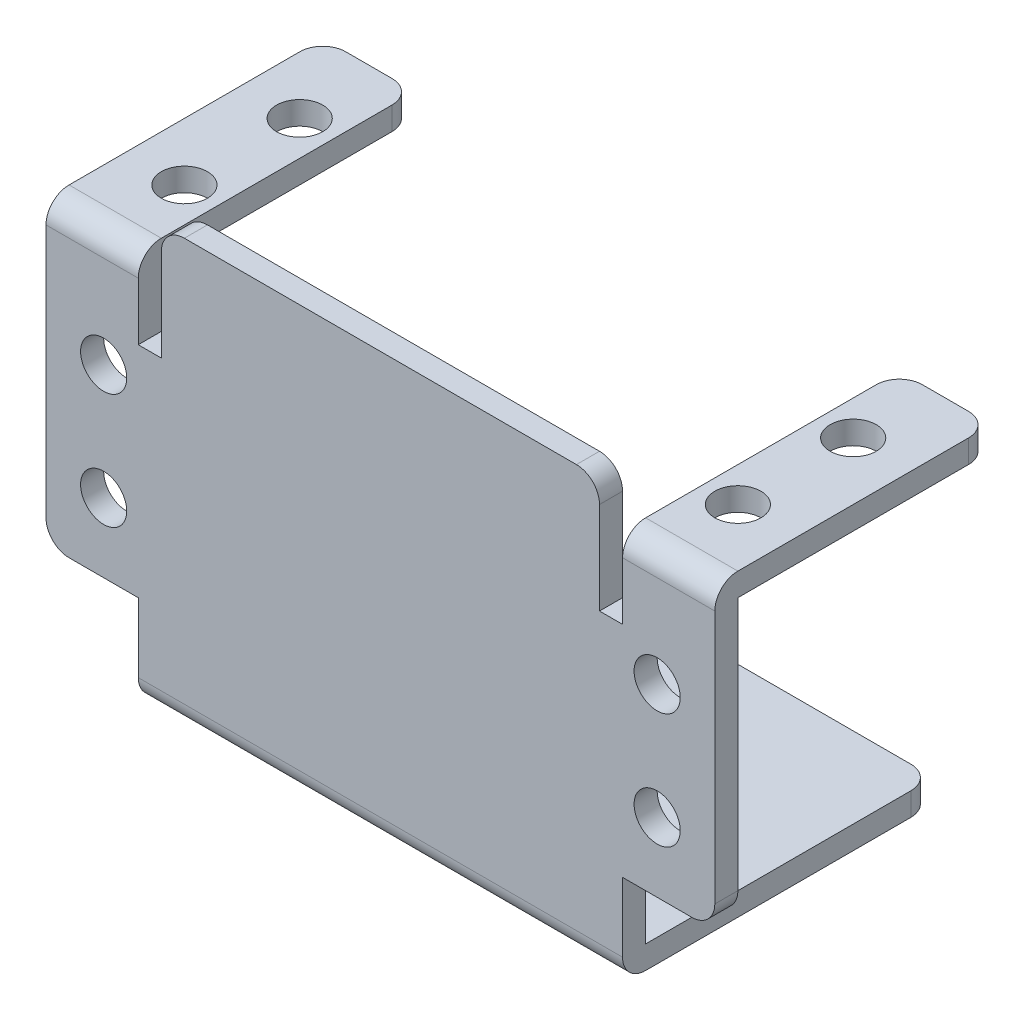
SolidWorks part; units mm, degrees
ref_plane "前视基准面" through (0, 0, 0) normal (0, 0, 1) x (1, 0, 0)
ref_plane "上视基准面" through (0, 0, 0) normal (0, 1, 0) x (1, 0, 0)
ref_plane "右视基准面" through (0, 0, 0) normal (1, 0, 0) x (0, 0, -1)
sketch "草图1" plane through (0, 0, 0) normal (0, 1, 0) x (1, 0, 0)
  line L1 (-65.2513, 34.186) -> (-23.2513, 34.186)
  line L2 (-65.2513, 34.186) -> (-65.2513, 9.186)
  line L3 (-65.2513, 9.186) -> (-23.2513, 9.186)
  line L4 (-23.2513, 34.186) -> (-23.2513, 9.186)
extrude "凸台-拉伸1" add sketch "草图1" along normal blind 2
sketch "草图2" plane through (0, 0, -9.186) normal (0, 0, 1) x (1, 0, 0)
  line L0 (-23.2513, 0) -> (-23.2513, 8)
  line L1 (-23.2513, 8) -> (-15.2513, 8)
  line L2 (-15.2513, 8) -> (-15.2513, 32)
  line L3 (-15.2513, 32) -> (-23.2513, 32)
  line L4 (-23.2513, 32) -> (-23.2513, 27)
  line L5 (-23.2513, 27) -> (-25.2513, 27)
  line L6 (-25.2513, 27) -> (-25.2513, 37)
  line L7 (-25.2513, 37) -> (-44.2513, 37)
  line L8 (-23.2513, 0) -> (-44.2513, 0)
  line L9 (-65.2513, 0) -> (-23.2513, 0) construction
  line L10 (-44.2513, -5.6049) -> (-44.2513, 43.7189) construction
  line L11 (-63.2513, 27) -> (-63.2513, 37)
  line L12 (-65.2513, 27) -> (-63.2513, 27)
  line L13 (-65.2513, 32) -> (-65.2513, 27)
  line L14 (-73.2513, 32) -> (-65.2513, 32)
  line L15 (-73.2513, 8) -> (-73.2513, 32)
  line L16 (-65.2513, 8) -> (-73.2513, 8)
  line L17 (-65.2513, 0) -> (-65.2513, 8)
  line L18 (-63.2513, 37) -> (-44.2513, 37)
  line L19 (-65.2513, 0) -> (-44.2513, 0)
extrude "凸台-拉伸2" add sketch "草图2" along normal blind 2
sketch "草图3" plane through (0, 32, 0) normal (0, 1, 0) x (1, 0, 0)
  line L0 (-73.2513, 7.186) -> (-73.2513, 31.186)
  line L1 (-73.2513, 31.186) -> (-65.2513, 31.186)
  line L2 (-65.2513, 31.186) -> (-65.2513, 7.186)
  line L3 (-65.2513, 7.186) -> (-73.2513, 7.186)
  line L4 (-23.2513, 7.186) -> (-23.2513, 31.186)
  line L5 (-23.2513, 9.186) -> (-23.2513, 34.186) construction
  line L6 (-23.2513, 31.186) -> (-15.2513, 31.186)
  line L7 (-15.2513, 31.186) -> (-15.2513, 7.186)
  line L8 (-15.2513, 7.186) -> (-23.2513, 7.186)
extrude "凸台-拉伸3" add sketch "草图3" along normal blind 2
fillet "圆角1" radius 2 13 edges at (-73.2513, 8, -8.186) (-63.2513, 37, -8.186) (-25.2513, 37, -8.186) (-15.2513, 8, -8.186) (-65.2513, 1, -34.186) (-23.2513, 1, -34.186) (-15.2513, 33, -31.186) (-23.2513, 33, -31.186) (-65.2513, 33, -31.186) (-73.2513, 33, -31.186) (-19.2513, 34, -7.186) (-69.2513, 34, -7.186) (-44.2513, 0, -7.186)
sketch "草图4" plane through (0, 34, 0) normal (0, 1, 0) x (1, 0, 0)
  line L0 (-44.2513, 37.6643) -> (-44.2513, -6.5196) construction
  line L1 (-19.2513, 31.186) -> (-19.2513, 24.186) construction
  line L2 (-17.2513, 31.186) -> (-21.2513, 31.186) construction
  line L3 (-44.2513, 24.186) -> (-20.2513, 24.186) construction
  line L4 (-20.2513, 24.186) -> (-68.2513, 24.186) construction
  circle A0 centre (-68.2513, 24.186) radius 2
  circle A1 centre (-20.2513, 24.186) radius 2
  circle A2 centre (-20.2513, 14.186) radius 2
  circle A3 centre (-68.2513, 14.186) radius 2
  dimension "D1" = 2
  dimension "D2" = 7
extrude "切除-拉伸1" cut sketch "草图4" against normal blind 2
sketch "草图5" plane through (0, 0, -9.186) normal (0, 0, -1) x (-1, 0, 0)
  line L0 (44.2513, 39.1452) -> (44.2513, -6.8567) construction
  line L1 (20.2513, 8) -> (20.2513, 14) construction
  line L2 (23.2513, 8) -> (17.2513, 8) construction
  line L3 (44.2513, 14) -> (20.2513, 14) construction
  line L4 (20.2513, 14) -> (68.2513, 14) construction
  circle A0 centre (68.2513, 14) radius 2
  circle A1 centre (20.2513, 14) radius 2
  circle A2 centre (20.2513, 24) radius 2
  circle A3 centre (68.2513, 24) radius 2
  dimension "D1" = 2
extrude "切除-拉伸2" cut sketch "草图5" against normal blind 2
sketch "草图6" plane through (0, 0, -9.186) normal (0, 0, -1) x (-1, 0, 0)
  line L33 (15.2513, 30.4155) -> (23.2513, 30.4155)
  line L34 (65.2513, 30.4155) -> (73.2513, 30.4155)
  line L35 (23.2513, 27) -> (23.2513, 8)
  line L36 (65.2513, 27) -> (65.2513, 8)
  line L48 (65.2513, 8) -> (71.2513, 8)
  line L49 (73.2513, 10) -> (73.2513, 32)
  line L50 (73.2513, 32) -> (65.2513, 32)
  line L51 (65.2513, 32) -> (65.2513, 27)
  line L52 (65.2513, 27) -> (63.2513, 27)
  line L53 (63.2513, 27) -> (63.2513, 35)
  line L54 (61.2513, 37) -> (27.2513, 37)
  line L55 (25.2513, 35) -> (25.2513, 27)
  line L56 (25.2513, 27) -> (23.2513, 27)
  line L57 (23.2513, 27) -> (23.2513, 32)
  line L58 (23.2513, 32) -> (15.2513, 32)
  line L59 (15.2513, 32) -> (15.2513, 10)
  line L60 (17.2513, 8) -> (23.2513, 8)
  line L61 (23.2513, 8) -> (23.2513, 2)
  line L62 (23.2513, 2) -> (65.2513, 2)
  line L63 (65.2513, 2) -> (65.2513, 8)
  line L64 (65.2513, 8) -> (71.2513, 8)
  line L65 (73.2513, 10) -> (73.2513, 30.4155)
  line L67 (65.2513, 30.4155) -> (65.2513, 27)
  line L73 (23.2513, 27) -> (23.2513, 30.4155)
  line L75 (15.2513, 30.4155) -> (15.2513, 10)
  line L76 (17.2513, 8) -> (23.2513, 8)
  line L79 (65.2513, 5) -> (65.2513, 8)
  circle A8 centre (20.2513, 24) radius 2
  circle A9 centre (20.2513, 14) radius 2
  circle A10 centre (68.2513, 24) radius 2
  circle A11 centre (68.2513, 14) radius 2
  arc A12 (71.2513, 8) -> (73.2513, 10) centre (71.2513, 10) ccw
  arc A13 (63.2513, 35) -> (61.2513, 37) centre (61.2513, 35) ccw
  arc A14 (27.2513, 37) -> (25.2513, 35) centre (27.2513, 35) ccw
  arc A15 (15.2513, 10) -> (17.2513, 8) centre (17.2513, 10) ccw
  arc A16 (71.2513, 8) -> (73.2513, 10) centre (71.2513, 10) ccw
  arc A17 (63.2513, 35) -> (61.2513, 37) centre (61.2513, 35) ccw
  arc A19 (15.2513, 10) -> (17.2513, 8) centre (17.2513, 10) ccw
  dimension "D1" = 0
